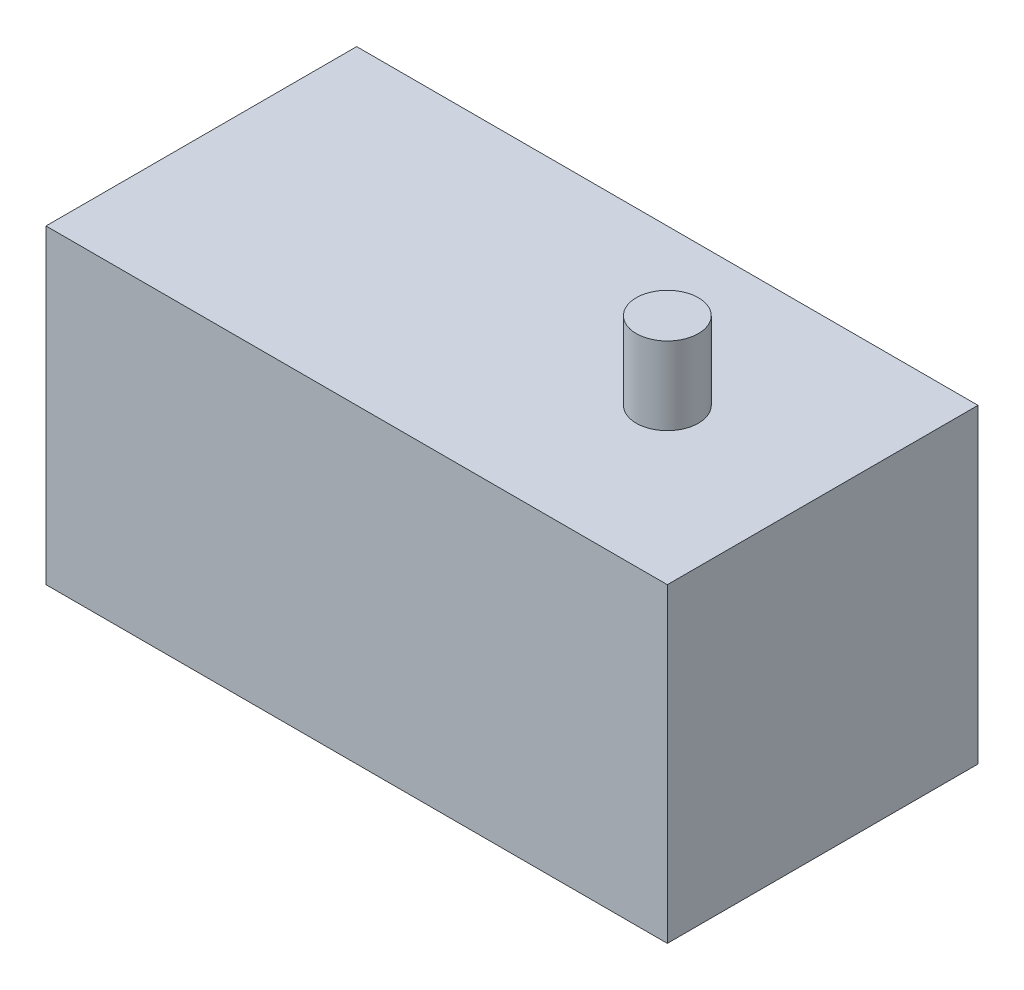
SolidWorks part; units mm, degrees
ref_plane "Front Plane" through (0, 0, 0) normal (0, 0, 1) x (1, 0, 0)
ref_plane "Top Plane" through (0, 0, 0) normal (0, 1, 0) x (1, 0, 0)
ref_plane "Right Plane" through (0, 0, 0) normal (1, 0, 0) x (0, 0, -1)
sketch "Sketch1" plane through (0, 0, 0) normal (0, 1, 0) x (1, 0, 0)
  line L1 (-20, -10) -> (20, -10)
  line L2 (-20, -10) -> (-20, 10)
  line L3 (-20, 10) -> (20, 10)
  line L4 (20, -10) -> (20, 10)
  line L5 (-20, -10) -> (20, 10) construction
  line L6 (-20, 10) -> (20, -10) construction
  point P0 (0, 0)
  dimension "D1" = 40
  dimension "D2" = 20
extrude "Boss-Extrude1" add sketch "Sketch1" along normal blind 20 contours L2 L3 L4 L1
sketch "Sketch2" plane through (0, 20, 0) normal (0, 1, 0) x (1, 0, 0)
  line L0 (20, -10) -> (20, 10) construction
  circle A0 centre (10, 0) radius 2
  dimension "D2" = 4
  dimension "D1" = 10
  dimension "D3" = 10
extrude "Boss-Extrude2" add sketch "Sketch2" along normal blind 5
sketch "Sketch3" plane through (-20, 0, 0) normal (-1, 0, 0) x (0, 0, 1)
  line L1 (-2.7673, 5.75) -> (2.2327, 5.75)
  line L2 (-2.7673, 5.75) -> (-2.7673, 4.25)
  line L3 (-2.7673, 4.25) -> (2.2327, 4.25)
  line L4 (2.2327, 5.75) -> (2.2327, 4.25)
  line L5 (-2.7673, 5.75) -> (2.2327, 4.25) construction
  line L6 (-2.7673, 4.25) -> (2.2327, 5.75) construction
  line L7 (-10, 20) -> (-10, 0) construction
  point P0 (-0.2673, 5)
  dimension "D1" = 5
  dimension "D2" = 1.5
  dimension "D3" = 5
  dimension "D4" = 7.2327
extrude "Cut-Extrude1" cut sketch "Sketch3" against normal blind 5
